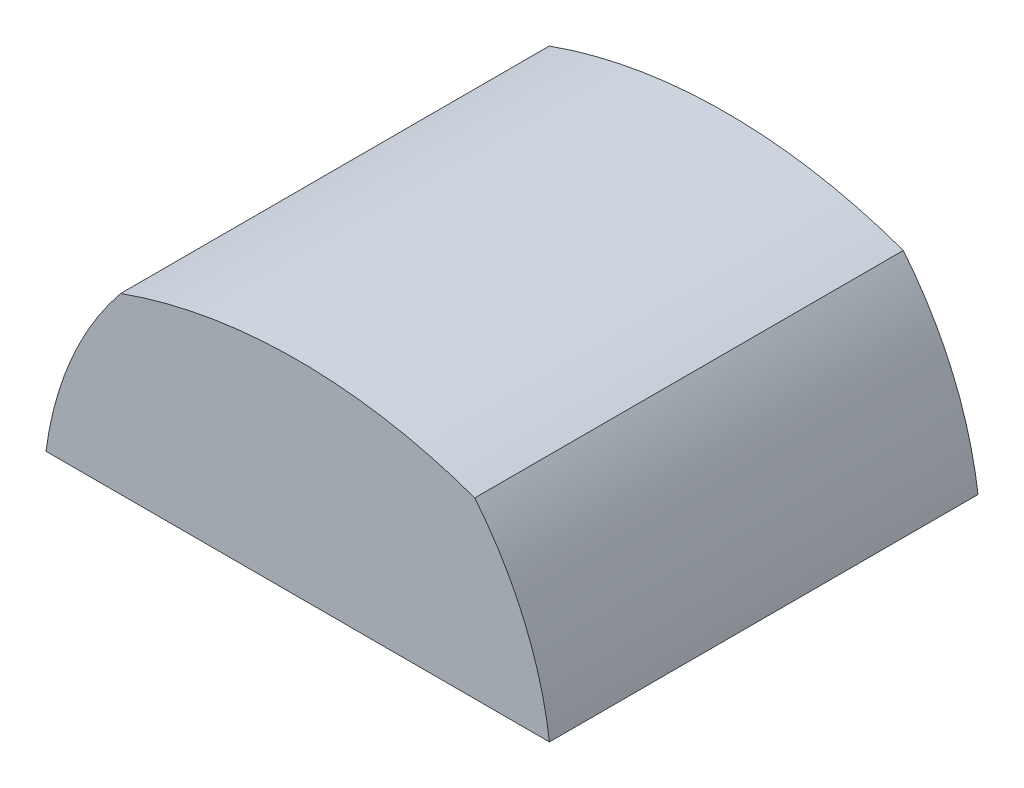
SolidWorks part; units mm, degrees
ref_plane "Front Plane" through (0, 0, 0) normal (0, 0, 1) x (1, 0, 0)
ref_plane "Top Plane" through (0, 0, 0) normal (0, 1, 0) x (1, 0, 0)
ref_plane "Right Plane" through (0, 0, 0) normal (1, 0, 0) x (0, 0, -1)
sketch "Sketch1" plane through (0, 0, 0) normal (0, 0, 1) x (1, 0, 0)
  line L0 (0, 0) -> (0, 58.8825) construction
  line L1 (-53.8575, 0) -> (53.8575, 0)
  arc A0 (-53.8575, 0) -> (-37.8807, 37.2364) centre (19.5561, -9.4535) cw
  arc A1 (-37.8807, 37.2364) -> (37.8807, 37.2364) centre (0, -68.4171) cw
  arc A2 (53.8575, 0) -> (37.8807, 37.2364) centre (-19.5561, -9.4535) ccw
extrude "Extrude1" add sketch "Sketch1" along normal blind 91.694
